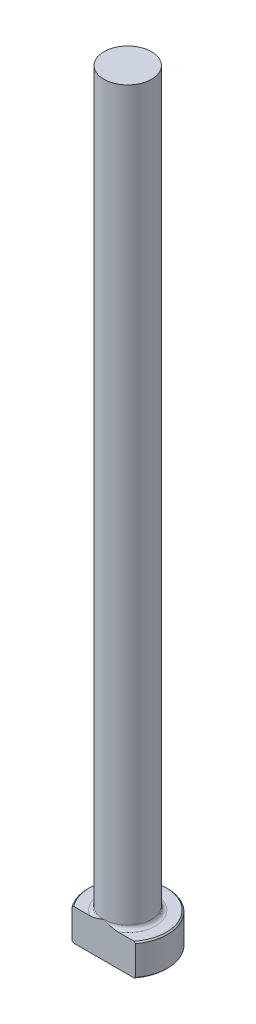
SolidWorks part; units mm, degrees
ref_plane "Front Plane" through (0, 0, 0) normal (0, 0, 1) x (1, 0, 0)
ref_plane "Top Plane" through (0, 0, 0) normal (0, 1, 0) x (1, 0, 0)
ref_plane "Right Plane" through (0, 0, 0) normal (1, 0, 0) x (0, 0, -1)
sketch "Sketch1" plane through (0, 0, 0) normal (0, 0, 1) x (1, 0, 0)
  line L0 (0, 259.9588) -> (0, -15.1925) construction
  line L1 (0, 0) -> (-7.9375, 0)
  line L2 (-7.9375, 0) -> (-7.9375, 6.35)
  line L3 (-7.9375, 6.35) -> (-4.7625, 6.35)
  line L4 (-4.7625, 6.35) -> (-4.7625, 152.4)
  line L5 (-4.7625, 152.4) -> (0, 152.4)
  line L6 (0, 152.4) -> (0, 0)
  dimension "L" = 152.4
  dimension "H" = 15.875
  dimension "T" = 6.35
  dimension "D" = 9.525
revolve "Revolve1" add sketch "Sketch1" angle 360 about L0
chamfer "Chamfer1" distance 0.254 angle 45 2 edges at (0, 6.35, 7.9375) (0, 0, 7.9375)
fillet "Fillet1" radius 0.762 1 edges at (0, 6.35, 4.7625)
sketch "Sketch2" plane through (0, 0, 0) normal (0, 1, 0) x (1, 0, 0)
  line L0 (-6.35, -4.7625) -> (6.35, -4.7625)
  circle A0 centre (0, 0) radius 7.9375 construction
  arc A1 (-6.35, -4.7625) -> (6.35, -4.7625) centre (0, 0) ccw
  circle A3 centre (0, 0) radius 4.7625 construction
  dimension "D1" = 0
extrude "Key" cut sketch "Sketch2" along normal through all
sketch "Pocket Sketch" plane through (0, 0, 0) normal (0, 0, 1) x (1, 0, 0)
  line L0 (-8.3344, 0) -> (-8.3344, 6.3754)
  line L1 (-8.3344, 6.3754) -> (-5.9214, 6.3754)
  line L2 (-5.1594, 7.1374) -> (-5.1594, 22.225)
  line L3 (-5.1594, 22.225) -> (0, 22.225)
  line L4 (0, 22.225) -> (0, 0)
  line L5 (0, 0) -> (-8.3344, 0)
  line L6 (0, 12.6104) -> (0, -2.4989) construction
  line L7 (-7.9375, 6.096) -> (-7.9375, 0.254) construction
  line L8 (7.6835, 6.35) -> (-7.6835, 6.35) construction
  line L9 (-4.7625, 152.4) -> (-4.7625, 7.112) construction
  line L10 (-5.9214, 6.3754) -> (-5.1594, 7.1374)
  point P3 (-5.1594, 6.3754)
  dimension "D1" = 16.6687
  dimension "D2" = 0.3969
  dimension "D3" = 0.0254
  dimension "D4" = 0.3969
  dimension "D5" = 10.3187
  dimension "D6" = 22.225
